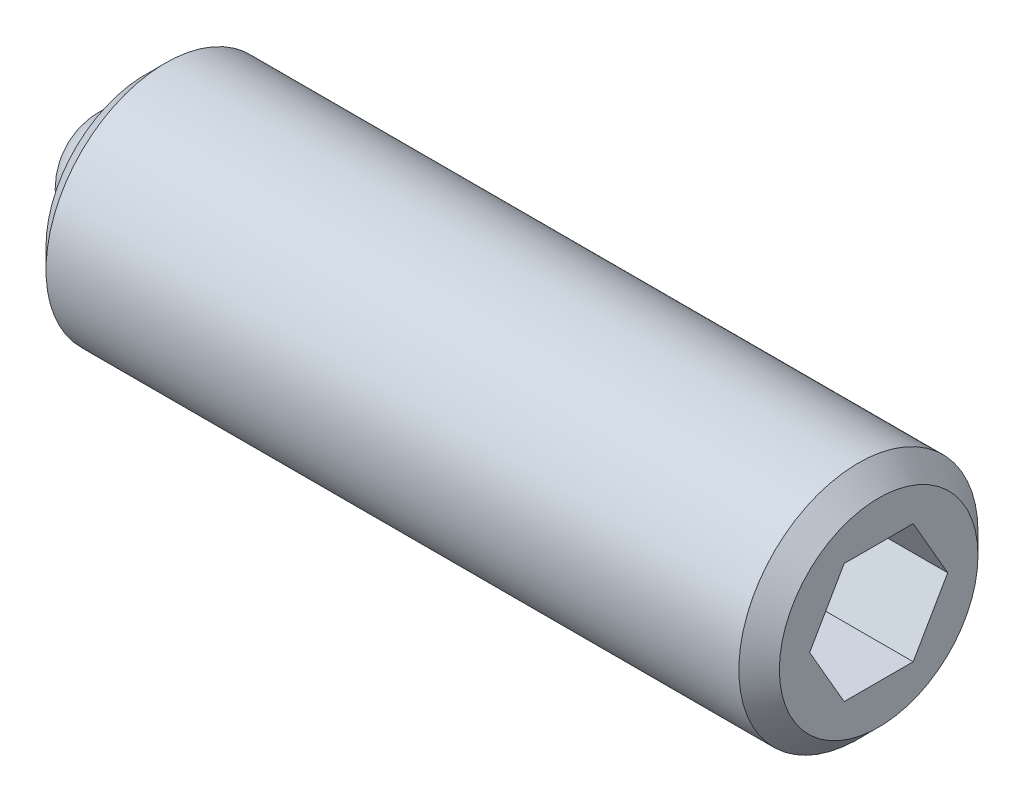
SolidWorks part; units mm, degrees
ref_plane "Front Plane" through (0, 0, 0) normal (0, 0, 1) x (1, 0, 0)
ref_plane "Top Plane" through (0, 0, 0) normal (0, 1, 0) x (1, 0, 0)
ref_plane "Right Plane" through (0, 0, 0) normal (1, 0, 0) x (0, 0, -1)
sketch "Sketch2" plane through (0, 0, 0) normal (1, 0, 0) x (0, 0, -1)
  circle A0 centre (0, 0) radius 1.5
  dimension "D1" = 3
extrude "Boss-Extrude1" add sketch "Sketch2" along normal blind 9.2
sketch "Sketch3" plane through (0, 0, 0) normal (-1, 0, 0) x (0, 0, 1)
  circle A0 centre (0, 0) radius 0.8
  dimension "D1" = 1.6
chamfer "Chamfer1" distance 0.254 angle 45 1 edges at (0, 0, -1.5)
chamfer "Chamfer2" distance 0.254 angle 45 1 edges at (9.2, 0, -1.5)
sketch "Sketch4" plane through (9.2, 0, 0) normal (1, 0, 0) x (0, 0, -1)
  line L1 (0.866, 0) -> (0.433, 0.75)
  line L2 (0.433, 0.75) -> (-0.433, 0.75)
  line L3 (-0.433, 0.75) -> (-0.866, 0)
  line L4 (-0.866, 0) -> (-0.433, -0.75)
  line L5 (-0.433, -0.75) -> (0.433, -0.75)
  line L6 (0.433, -0.75) -> (0.866, 0)
  circle A0 centre (0, 0) radius 0.75 construction
  dimension "D1" = 1.5
extrude "Cut-Extrude2" cut sketch "Sketch4" against normal blind 2
extrude "Cut-Extrude3" cut sketch "Sketch3" against normal blind 0.8
sketch "Sketch5" plane through (0, 0, 0) normal (-1, 0, 0) x (0, 0, 1)
  line L0 (0, 0) -> (0, -0.8)
  line L1 (0, 0) -> (0, 0.8)
  arc A0 (0, 0.8) -> (0, -0.8) centre (0, 0) ccw
  dimension "D1" = 0.8
revolve "Revolve1" add sketch "Sketch5" angle 360 about L1
